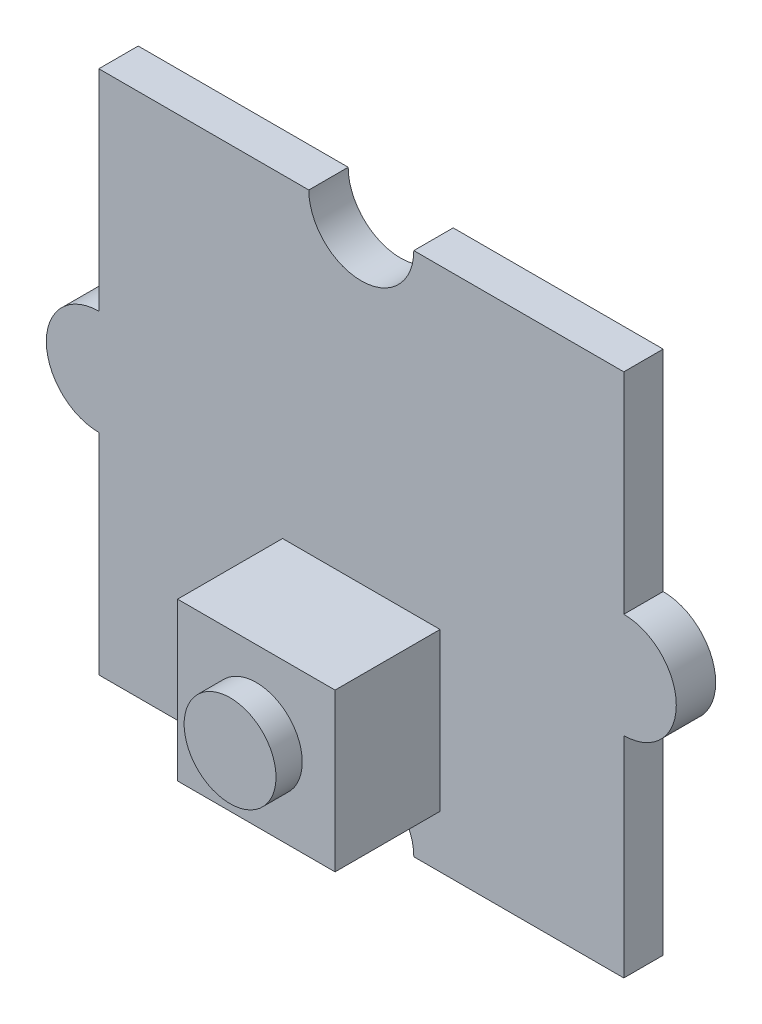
SolidWorks part; units mm, degrees
ref_plane "Plan de face" through (0, 0, 0) normal (0, 0, 1) x (1, 0, 0)
ref_plane "Plan de dessus" through (0, 0, 0) normal (0, 1, 0) x (1, 0, 0)
ref_plane "Plan de droite" through (0, 0, 0) normal (1, 0, 0) x (0, 0, -1)
sketch "Esquisse1" plane through (0, 0, 0) normal (0, 0, 1) x (1, 0, 0)
  line L0 (0, 12) -> (0, 20)
  line L1 (0, 0) -> (20, 0)
  line L2 (0, 0) -> (0, 8)
  line L3 (0, 20) -> (20, 20)
  line L4 (20, 0) -> (20, 8)
  line L5 (20, 12) -> (20, 20)
  arc A0 (0, 12) -> (0, 8) centre (0, 10) ccw
  arc A1 (20, 8) -> (20, 12) centre (20, 10) ccw
  dimension "D3" = 4
  dimension "D4" = 4
  dimension "D1" = 20
  dimension "D2" = 20
extrude "Boss.-Extru.1" add sketch "Esquisse1" along normal blind 1.5
sketch "Esquisse2" plane through (0, 0, 1.5) normal (0, 0, 1) x (1, 0, 0)
  line L0 (0, 8) -> (20, 8) construction
  line L2 (7, 8) -> (13, 8)
  line L3 (7, 8) -> (7, 2)
  line L4 (7, 2) -> (13, 2)
  line L5 (13, 8) -> (13, 2)
  line L6 (0, 8) -> (0, 0) construction
  dimension "D1" = 6
  dimension "D2" = 6
  dimension "D3" = 7
extrude "Boss.-Extru.2" add sketch "Esquisse2" along normal blind 4
sketch "Esquisse3" plane through (0, 0, 5.5) normal (0, 0, 1) x (1, 0, 0)
  line L0 (7, 8) -> (7, 2) construction
  line L1 (0, 0) -> (20, 0) construction
  circle A0 centre (10, 5) radius 1.75
  dimension "D1" = 3
  dimension "D2" = 5
extrude "Boss.-Extru.3" add sketch "Esquisse3" along normal blind 1
sketch "Esquisse4" plane through (0, 0, 1.5) normal (0, 0, 1) x (1, 0, 0)
  line L0 (20, 20) -> (0, 20) construction
  line L1 (0, 0) -> (20, 0) construction
  circle A0 centre (10, 20) radius 2
  circle A1 centre (10, 0) radius 2
extrude "Enlèv. mat.-Extru.1" cut sketch "Esquisse4" against normal blind 1.5
